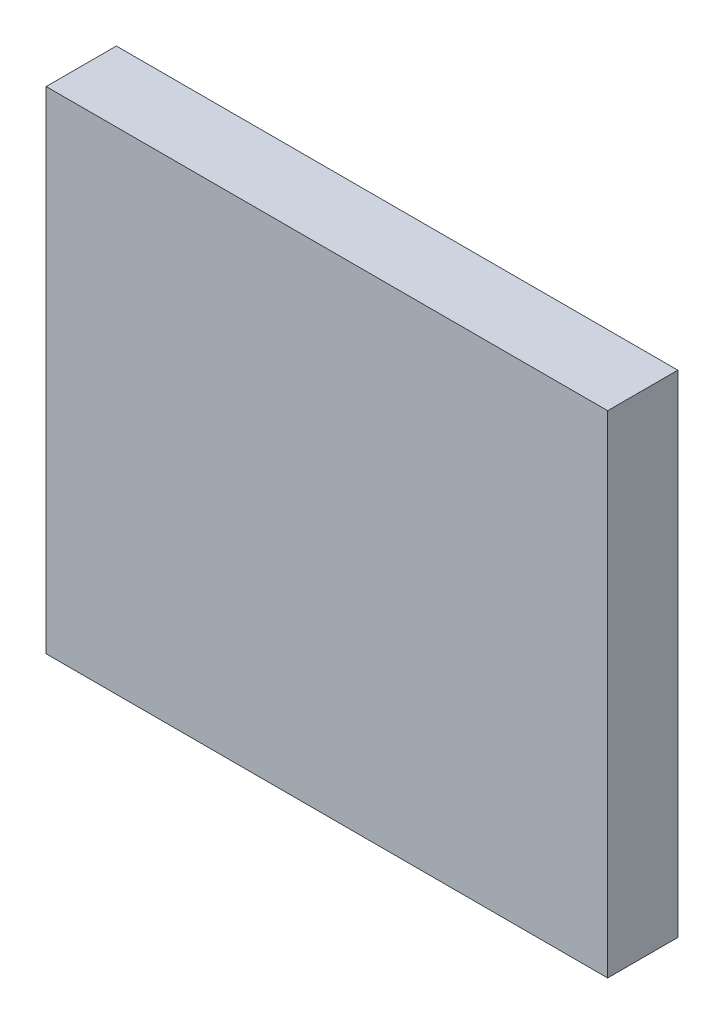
SolidWorks part; units mm, degrees
ref_plane "Front Plane" through (0, 0, 0) normal (0, 0, 1) x (1, 0, 0)
ref_plane "Top Plane" through (0, 0, 0) normal (0, 1, 0) x (1, 0, 0)
ref_plane "Right Plane" through (0, 0, 0) normal (1, 0, 0) x (0, 0, -1)
sketch "Sketch1" plane through (0, 0, 0) normal (0, 0, 1) x (1, 0, 0)
  line L1 (-8, 7) -> (8, 7)
  line L2 (-8, 7) -> (-8, -7)
  line L3 (-8, -7) -> (8, -7)
  line L4 (8, 7) -> (8, -7)
  line L5 (-8, 7) -> (8, -7) construction
  line L6 (-8, -7) -> (8, 7) construction
  point P0 (0, 0)
  dimension "D1" = 14
  dimension "D2" = 16
extrude "Boss-Extrude1" add sketch "Sketch1" along normal blind 2
